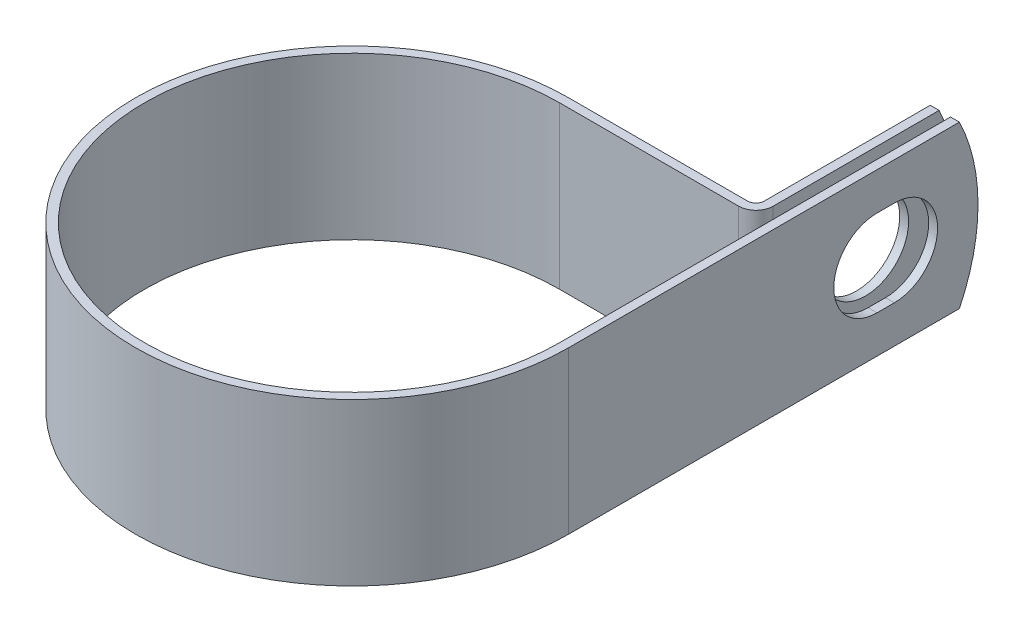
SolidWorks part; units mm, degrees
ref_plane "Front Plane" through (0, 0, 0) normal (0, 0, 1) x (1, 0, 0)
ref_plane "Top Plane" through (0, 0, 0) normal (0, 1, 0) x (1, 0, 0)
ref_plane "Right Plane" through (0, 0, 0) normal (1, 0, 0) x (0, 0, -1)
sketch "Sketch1" plane through (0, 0, 0) normal (0, 1, 0) x (1, 0, 0)
  line L0 (0, 28.575) -> (24.6228, 28.575)
  line L1 (28.575, 0) -> (28.575, 28.575)
  line L2 (27.0002, 56.3372) -> (27.0002, 30.9524)
  line L5 (28.575, 28.575) -> (28.575, 56.3372)
  arc A0 (0, 28.575) -> (28.575, 0) centre (0, 0) ccw
  arc A3 (24.6228, 28.575) -> (27.0002, 30.9524) centre (24.6228, 30.9524) ccw
extrude "Extrude-Thin1" add sketch "Sketch1" along normal mid plane 22.225 thin
sketch "Sketch2" plane through (25.781, 0, 0) normal (-1, 0, 0) x (0, 0, 1)
  line L0 (-56.3372, 11.1125) -> (-56.3372, -11.1125) construction
  line L7 (0, 11.1125) -> (0, -11.1125) construction
  circle A0 centre (-43.6372, 0) radius 5.9436
  point P2 (-56.3372, 0)
extrude "Cut-Extrude1" cut sketch "Sketch2" against normal up to surface (1.2192 mm away)
sketch "Sketch3" plane through (29.7942, 0, 0) normal (1, 0, 0) x (0, 0, -1)
  line L0 (42.4434, 0) -> (44.831, 0) construction
  line L1 (42.4434, 5.9436) -> (44.831, 5.9436)
  line L2 (42.4434, -5.9436) -> (44.831, -5.9436)
  line L3 (56.3372, 11.1125) -> (56.3372, -11.1125) construction
  arc A0 (42.4434, 5.9436) -> (42.4434, -5.9436) centre (42.4434, 0) ccw
  arc A1 (44.831, -5.9436) -> (44.831, 5.9436) centre (44.831, 0) ccw
  point P3 (43.6372, 0)
  point P8 (56.3372, 0)
  point P11 (36.4998, 0)
  point P12 (50.7746, 0)
extrude "Cut-Extrude2" cut sketch "Sketch3" against normal up to surface (1.2192 mm away)
sketch "Sketch4" plane through (25.781, 0, 0) normal (-1, 0, 0) x (0, 0, 1)
  line L0 (-56.3372, 11.1125) -> (-56.3372, -11.1125)
  line L1 (-56.3372, 11.1125) -> (-53.7773, 11.1125)
  line L2 (-56.3372, 11.1125) -> (-30.9524, 11.1125) construction
  line L3 (-56.3372, -11.1125) -> (-53.7773, -11.1125)
  line L4 (-56.3372, -11.1125) -> (-30.9524, -11.1125) construction
  arc A0 (-53.7773, 11.1125) -> (-53.7773, -11.1125) centre (-30.9372, 0) ccw
extrude "Cut-Extrude3" cut sketch "Sketch4" against normal through all contours A0 M4 M5 | A0 L0 M2
equation "\"D1@Sketch3\" = \"D2@Sketch2\""
equation "\"D7@Sketch1\" = \"D3@Sketch2\" + \"D1@Sketch3\""
equation "\"D1@Sketch4\" = ( \"D1@Extrude-Thin1\" + .125 ) * 2"
equation "\"D2@Sketch1\"=1.95*\"D5@Extrude-Thin1\""
equation "\"D2@Sketch3\" = \"D1@Sketch2\""
